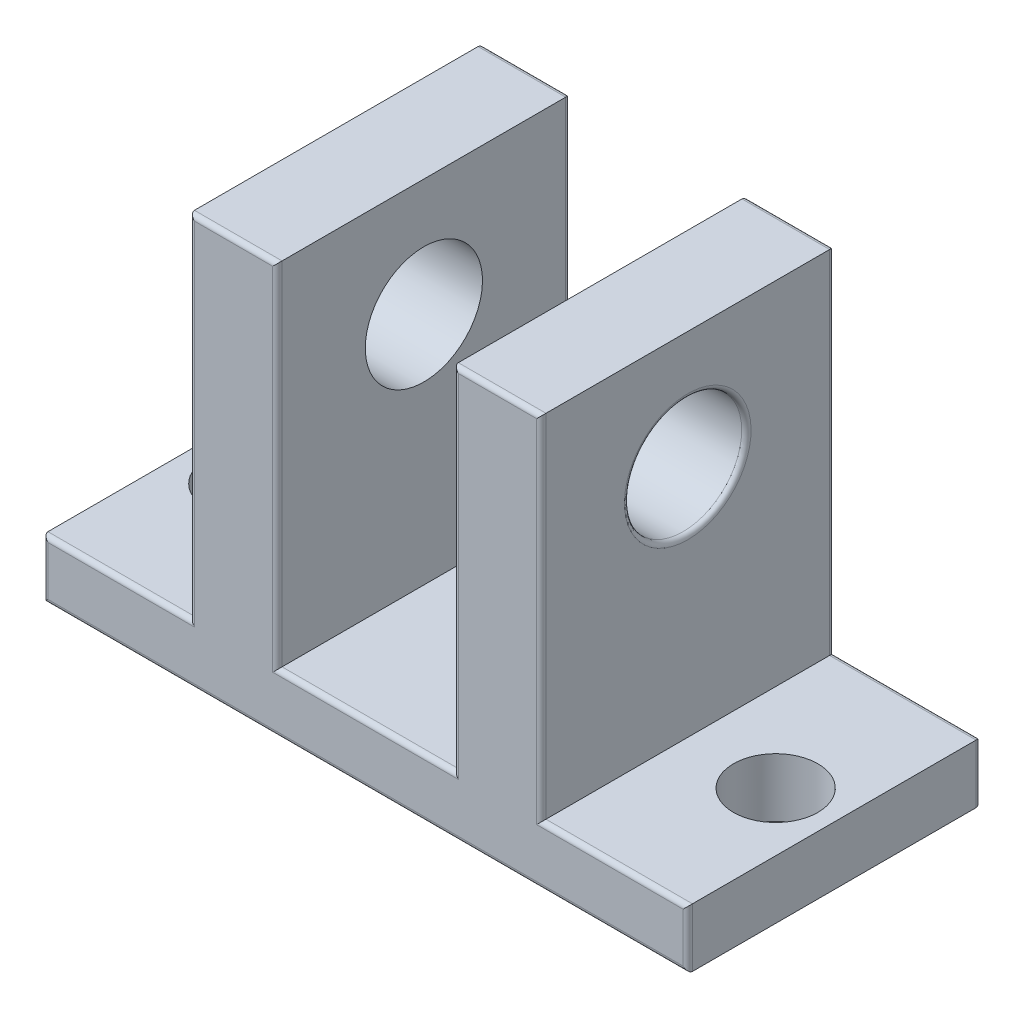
SolidWorks part; units mm, degrees
ref_plane "Plane1" through (0, 0, 0) normal (0, 0, 1) x (1, 0, 0)
ref_plane "Plane2" through (0, 0, 0) normal (0, 1, 0) x (1, 0, 0)
ref_plane "Plane3" through (0, 0, 0) normal (1, 0, 0) x (0, 0, -1)
sketch "Sketch1" plane through (0, 0, 0) normal (0, 0, 1) x (1, 0, 0)
  line L0 (-17.4625, 0) -> (17.4625, 0)
  line L1 (17.4625, 0) -> (17.4625, 3.175)
  line L2 (17.4625, 3.175) -> (9.525, 3.175)
  line L3 (9.525, 3.175) -> (9.525, 22.225)
  line L4 (9.525, 22.225) -> (4.7752, 22.225)
  line L5 (4.7752, 22.225) -> (4.7752, 3.175)
  line L6 (4.7752, 3.175) -> (-4.7752, 3.175)
  line L7 (-4.7752, 3.175) -> (-4.7752, 22.225)
  line L8 (-4.7752, 22.225) -> (-9.525, 22.225)
  line L9 (-9.525, 22.225) -> (-9.525, 3.175)
  line L10 (-9.525, 3.175) -> (-17.4625, 3.175)
  line L11 (-17.4625, 3.175) -> (-17.4625, 0)
  dimension "D1" = 4.7752
  dimension "D2" = 4.7752
  dimension "D3" = 9.525
  dimension "D4" = 9.525
  dimension "D5" = 17.4625
  dimension "D6" = 17.4625
  dimension "D7" = 3.175
  dimension "D8" = 3.175
  dimension "D9" = 3.175
  dimension "D10" = 22.225
  dimension "D11" = 22.225
extrude "Base-Extrude" add sketch "Sketch1" along normal blind 15.875
sketch "Sketch2" plane through (9.525, 0, 0) normal (1, 0, 0) x (0, 0, -1)
  line L0 (-15.875, 3.175) -> (-15.875, 22.225) construction
  line L1 (-15.875, 22.225) -> (0, 22.225) construction
  circle A0 centre (-7.9375, 15.875) radius 3.175
  dimension "D1" = 6.35
  dimension "D2" = 7.9375
  dimension "D3" = 6.35
extrude "Cut-Extrude1" cut sketch "Sketch2" against normal through all
sketch "Sketch3" plane through (0, 0, 0) normal (0, 1, 0) x (1, 0, 0)
  line L0 (-9.525, -7.9375) -> (-4.7752, -7.9375) construction
  circle A0 centre (-14.2875, -7.9375) radius 2.286
  circle A1 centre (14.2875, -7.9375) radius 2.286
  dimension "D1" = 4.572
  dimension "D2" = 14.2875
  dimension "D3" = 14.2875
extrude "Cut-Extrude3" cut sketch "Sketch3" along normal through all
fillet "Fillet1" radius 0.254
